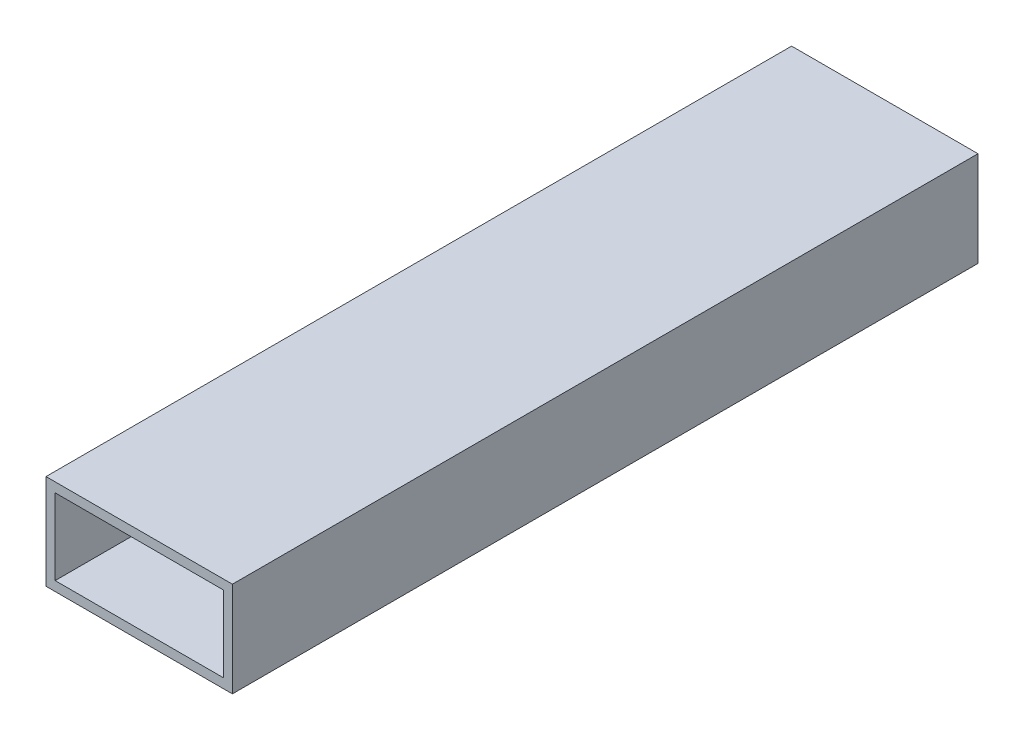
SolidWorks part; units mm, degrees
ref_plane "前视基准面" through (0, 0, 0) normal (0, 0, 1) x (1, 0, 0)
ref_plane "上视基准面" through (0, 0, 0) normal (0, 1, 0) x (1, 0, 0)
ref_plane "右视基准面" through (0, 0, 0) normal (1, 0, 0) x (0, 0, -1)
sketch "草图1" plane through (0, 0, 0) normal (0, 0, 1) x (1, 0, 0)
  line L1 (12.75, 6.5) -> (-12.75, 6.5)
  line L2 (12.75, 6.5) -> (12.75, -6.5)
  line L3 (12.75, -6.5) -> (-12.75, -6.5)
  line L4 (-12.75, 6.5) -> (-12.75, -6.5)
  line L5 (-11.5, 5.2) -> (11.5, 5.2)
  line L6 (-11.5, 5.2) -> (-11.5, -5.2)
  line L7 (-11.5, -5.2) -> (11.5, -5.2)
  line L8 (11.5, 5.2) -> (11.5, -5.2)
  line L9 (12.75, 6.5) -> (-12.75, -6.5) construction
  line L10 (12.75, -6.5) -> (-12.75, 6.5) construction
  point P0 (0, 0)
extrude "凸台-拉伸1" add sketch "草图1" along normal blind 102
